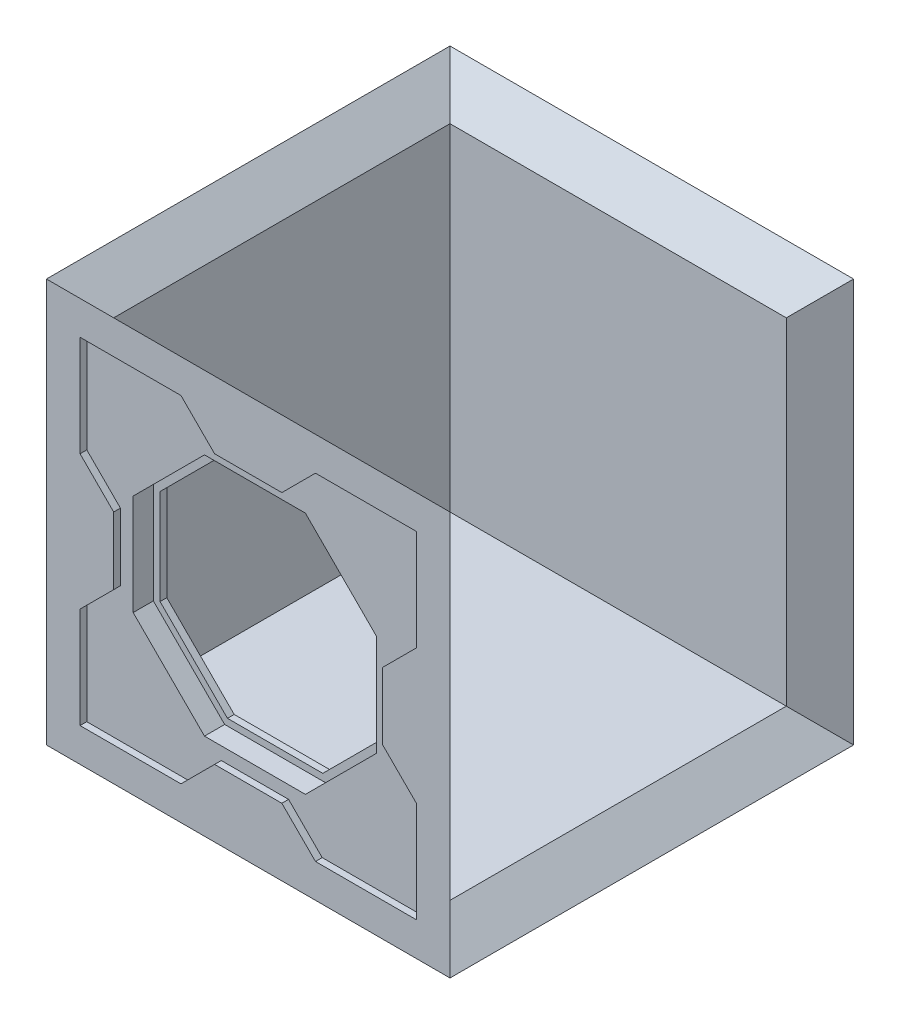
SolidWorks part; units mm, degrees
ref_plane "Front Plane" through (0, 0, 0) normal (0, 0, 1) x (1, 0, 0)
ref_plane "Top Plane" through (0, 0, 0) normal (0, 1, 0) x (1, 0, 0)
ref_plane "Right Plane" through (0, 0, 0) normal (1, 0, 0) x (0, 0, -1)
sketch "Sketch2" plane through (0, 0, 0) normal (0, 1, 0) x (1, 0, 0)
  line L1 (0, 0) -> (120, 0)
  line L2 (0, 0) -> (0, 120)
  line L3 (0, 120) -> (120, 120)
  line L4 (120, 0) -> (120, 120)
  dimension "D1" = 120
  dimension "D2" = 120
extrude "Boss-Extrude1" add sketch "Sketch2" along normal blind 10
sketch "Sketch4" plane through (0, 10, 0) normal (0, 1, 0) x (1, 0, 0)
  line L0 (0, 120) -> (120, 120)
  line L1 (120, 120) -> (120, 110)
  line L2 (120, 0) -> (120, 120) construction
  line L3 (120, 110) -> (10, 110)
  line L4 (10, 110) -> (10, 10)
  line L5 (10, 10) -> (120, 10)
  line L6 (120, 10) -> (120, 0)
  line L7 (120, 0) -> (0, 0)
  line L8 (0, 0) -> (0, 120)
  dimension "D1" = 10
  dimension "D2" = 10
  dimension "D3" = 10
extrude "Boss-Extrude2" add sketch "Sketch4" along normal blind 110
chamfer "Chamfer1" distance 10 angle 45 6 edges at (120, 65, -10) (120, 10, -60) (120, 65, -110) (65, 120, -110) (65, 120, -10) (10, 120, -60)
sketch "Sketch5" plane through (0, 0, -110) normal (0, 0, 1) x (1, 0, 0)
  line L0 (10, 110) -> (10, 10) construction
  line L18 (10, 10) -> (110, 10) construction
  line L19 (47.5, 25) -> (47.5, 22.5)
  line L21 (52.5, 22.5) -> (52.5, 25)
  line L22 (52.5, 25) -> (55, 25)
  line L23 (55, 25) -> (55, 17.5)
  line L24 (55, 17.5) -> (45, 17.5)
  line L25 (45, 17.5) -> (45, 25)
  line L26 (45, 25) -> (47.5, 25)
  line L27 (67.5, 25) -> (65, 25)
  line L28 (65, 25) -> (65, 17.5)
  line L29 (65, 17.5) -> (75, 17.5)
  line L30 (75, 17.5) -> (75, 25)
  line L31 (75, 25) -> (72.5, 25)
  line L32 (72.5, 25) -> (72.5, 22.5)
  line L34 (67.5, 22.5) -> (67.5, 25)
  arc A2 (47.5, 22.5) -> (52.5, 22.5) centre (50, 22.5) ccw
  arc A3 (67.5, 22.5) -> (72.5, 22.5) centre (70, 22.5) ccw
  dimension "D1" = 5
  dimension "D2" = 20
  dimension "D3" = 12.5
  dimension "D4" = 2.5
  dimension "D5" = 40
  dimension "D6" = 5
  dimension "D7" = 5
extrude "Boss-Extrude3" add sketch "Sketch5" along normal blind 100
sketch "Sketch7" plane through (0, 0, 0) normal (0, 0, 1) x (1, 0, 0)
  line L0 (10, 110) -> (40, 110)
  line L1 (40, 110) -> (50, 100)
  line L2 (50, 100) -> (70, 100)
  line L3 (70, 100) -> (80, 110)
  line L4 (80, 110) -> (110, 110)
  line L5 (10, 110) -> (10, 80)
  line L6 (10, 80) -> (20, 70)
  line L7 (20, 70) -> (20, 50)
  line L8 (20, 50) -> (10, 40)
  line L9 (10, 40) -> (10, 10)
  line L10 (10, 10) -> (40, 10)
  line L11 (40, 10) -> (50, 20)
  line L12 (50, 20) -> (70, 20)
  line L13 (70, 20) -> (80, 10)
  line L14 (80, 10) -> (110, 10)
  line L15 (110, 10) -> (110, 40)
  line L16 (110, 40) -> (100, 50)
  line L17 (100, 50) -> (100, 70)
  line L18 (100, 70) -> (110, 80)
  line L19 (110, 80) -> (110, 110)
  line L20 (75, 96.2132) -> (45, 96.2132)
  line L21 (45, 96.2132) -> (23.7868, 75)
  line L22 (23.7868, 75) -> (23.7868, 45)
  line L23 (23.7868, 45) -> (45, 23.7868)
  line L24 (45, 23.7868) -> (75, 23.7868)
  line L25 (75, 23.7868) -> (96.2132, 45)
  line L26 (96.2132, 45) -> (96.2132, 75)
  line L27 (96.2132, 75) -> (75, 96.2132)
  line L28 (10, 110) -> (110, 110) construction
  line L29 (110, 110) -> (110, 10) construction
  line L30 (0, 120) -> (120, 120) construction
  line L31 (60, 120) -> (60, 0) construction
  line L32 (0, 0) -> (120, 0) construction
  line L33 (110, 10) -> (10, 10) construction
  line L34 (0, 120) -> (0, 0) construction
  line L35 (0, 60) -> (120, 60) construction
  line L36 (120, 120) -> (120, 0) construction
  line L37 (120, 60) -> (120, 0) construction
  line L38 (10, 10) -> (10, 110) construction
  circle A0 centre (60, 60) radius 36.2132 construction
  dimension "D1" = 30
  dimension "D2" = 20
  dimension "D3" = 30
  dimension "D4" = 10
  dimension "D5" = 10
  dimension "D6" = 10
  dimension "D7" = 20
  dimension "D8" = 10
  dimension "D9" = 30
  dimension "D10" = 10
  dimension "D11" = 10
  dimension "D12" = 100
extrude "Cut-Extrude1" cut sketch "Sketch7" against normal blind 2
sketch "Sketch8" plane through (0, 0, 0) normal (-1, 0, 0) x (0, 0, 1)
  line L0 (-110, 110) -> (-80, 110)
  line L1 (-80, 110) -> (-70, 100)
  line L2 (-70, 100) -> (-50, 100)
  line L3 (-50, 100) -> (-40, 110)
  line L4 (-40, 110) -> (-10, 110)
  line L5 (-110, 110) -> (-110, 80)
  line L6 (-110, 80) -> (-100, 70)
  line L7 (-100, 70) -> (-100, 50)
  line L8 (-100, 50) -> (-110, 40)
  line L9 (-110, 40) -> (-110, 10)
  line L10 (-110, 10) -> (-80, 10)
  line L11 (-80, 10) -> (-70, 20)
  line L12 (-70, 20) -> (-50, 20)
  line L13 (-50, 20) -> (-40, 10)
  line L14 (-40, 10) -> (-10, 10)
  line L15 (-10, 10) -> (-10, 40)
  line L16 (-10, 40) -> (-20, 50)
  line L17 (-20, 50) -> (-20, 70)
  line L18 (-20, 70) -> (-10, 80)
  line L19 (-10, 80) -> (-10, 110)
  line L20 (-45, 96.2132) -> (-75, 96.2132)
  line L21 (-75, 96.2132) -> (-96.2132, 75)
  line L22 (-96.2132, 75) -> (-96.2132, 45)
  line L23 (-96.2132, 45) -> (-75, 23.7868)
  line L24 (-75, 23.7868) -> (-45, 23.7868)
  line L25 (-45, 23.7868) -> (-23.7868, 45)
  line L26 (-23.7868, 45) -> (-23.7868, 75)
  line L27 (-23.7868, 75) -> (-45, 96.2132)
  line L28 (-120, 60) -> (0, 60) construction
  line L29 (-120, 120) -> (-120, 0) construction
  line L30 (0, 120) -> (0, 0) construction
  line L32 (-120, 120) -> (0, 120) construction
  line L33 (-60, 120) -> (-60, 0) construction
  line L34 (-120, 0) -> (0, 0) construction
  line L36 (-10, 10) -> (-10, 110) construction
  line L37 (-10, 110) -> (-110, 110) construction
  line L38 (-110, 110) -> (-110, 10) construction
  line L39 (-110, 10) -> (-10, 10) construction
  circle A0 centre (-60, 60) radius 36.2132 construction
  dimension "D1" = 30
  dimension "D2" = 20
  dimension "D3" = 30
  dimension "D4" = 10
  dimension "D5" = 10
  dimension "D6" = 10
  dimension "D7" = 20
  dimension "D8" = 10
  dimension "D9" = 10
  dimension "D10" = 30
  dimension "D11" = 10
  dimension "D12" = 100
extrude "Cut-Extrude2" cut sketch "Sketch8" against normal blind 2
sketch "Sketch9" plane through (0, 0, -120) normal (0, 0, -1) x (-1, 0, 0)
  line L0 (-120, 60) -> (0, 60) construction
  line L1 (-120, 120) -> (-120, 0) construction
  line L2 (0, 120) -> (0, 0) construction
  line L3 (-110, 110) -> (-80, 110)
  line L4 (-120, 120) -> (0, 120) construction
  line L5 (-60, 120) -> (-60, 0) construction
  line L6 (-120, 0) -> (0, 0) construction
  line L7 (-80, 110) -> (-70, 100)
  line L8 (-110, 10) -> (-110, 110) construction
  line L9 (-110, 110) -> (-10, 110) construction
  line L10 (-10, 110) -> (-10, 10) construction
  line L11 (-10, 10) -> (-110, 10) construction
  line L12 (-70, 100) -> (-50, 100)
  line L13 (-50, 100) -> (-40, 110)
  line L14 (-40, 110) -> (-10, 110)
  line L15 (-110, 110) -> (-110, 80)
  line L16 (-110, 80) -> (-100, 70)
  line L17 (-100, 70) -> (-100, 50)
  line L18 (-100, 50) -> (-110, 40)
  line L19 (-110, 40) -> (-110, 10)
  line L20 (-110, 10) -> (-80, 10)
  line L21 (-80, 10) -> (-70, 20)
  line L22 (-70, 20) -> (-50, 20)
  line L23 (-50, 20) -> (-40, 10)
  line L24 (-40, 10) -> (-10, 10)
  line L25 (-10, 10) -> (-10, 40)
  line L26 (-10, 40) -> (-20, 50)
  line L27 (-20, 50) -> (-20, 70)
  line L28 (-20, 70) -> (-10, 80)
  line L29 (-10, 80) -> (-10, 110)
  line L30 (-45, 96.2132) -> (-75, 96.2132)
  line L31 (-75, 96.2132) -> (-96.2132, 75)
  line L32 (-96.2132, 75) -> (-96.2132, 45)
  line L33 (-96.2132, 45) -> (-75, 23.7868)
  line L34 (-75, 23.7868) -> (-45, 23.7868)
  line L35 (-45, 23.7868) -> (-23.7868, 45)
  line L36 (-23.7868, 45) -> (-23.7868, 75)
  line L37 (-23.7868, 75) -> (-45, 96.2132)
  line L40 (-60, 160.9007) -> (-60, 40.9007) construction
  circle A0 centre (-60, 60) radius 36.2132 construction
  dimension "D1" = 10
  dimension "D2" = 100
  dimension "D3" = 10
  dimension "D4" = 30
  dimension "D5" = 20
  dimension "D6" = 30
  dimension "D7" = 10
  dimension "D8" = 10
  dimension "D9" = 10
  dimension "D10" = 20
  dimension "D11" = 10
  dimension "D13" = 30
extrude "Cut-Extrude3" cut sketch "Sketch9" against normal blind 2
sketch "Sketch11" plane through (75, 0, 0) normal (1, 0, 0) x (0, 0, -1)
  line L0 (10, 17.5) -> (110, 17.5) construction
  line L1 (15, 17.5) -> (105, 17.5)
  line L2 (15, 17.5) -> (15, 25)
  line L3 (15, 25) -> (105, 25)
  line L4 (105, 17.5) -> (105, 25)
  line L5 (10, 25) -> (110, 25) construction
  line L6 (110, 17.5) -> (110, 25) construction
  point P8 (105, 21.25)
  dimension "D1" = 90
  dimension "D2" = 5
extrude "Cut-Extrude5" cut sketch "Sketch11" against normal up to surface (30 mm away) contours L3 L4 L1 L2
sketch "Sketch12" plane through (75, 0, 0) normal (1, 0, 0) x (0, 0, -1)
  line L0 (105, 17.5) -> (110, 17.5)
  line L1 (110, 10) -> (110, 110) construction
  line L2 (110, 17.5) -> (110, 25) construction
  line L3 (110, 17.5) -> (110, 12.5)
  line L4 (110, 12.5) -> (105, 17.5)
  line L5 (15, 17.5) -> (10, 17.5)
  line L6 (10, 17.5) -> (10, 12.5)
  line L7 (10, 12.5) -> (15, 17.5)
  dimension "D1" = 5
extrude "Boss-Extrude5" add sketch "Sketch12" against normal up to surface (30 mm away)
fillet "Fillet1" radius 0.5 16 edges at (45, 25, -12.5) (47.5, 25, -12.5) (52.5, 25, -12.5) (55, 25, -12.5) (75, 25, -12.5) (72.5, 25, -12.5) (65, 25, -12.5) (67.5, 25, -12.5) (45, 25, -107.5) (47.5, 25, -107.5) (52.5, 25, -107.5) (55, 25, -107.5) (65, 25, -107.5) (67.5, 25, -107.5) (72.5, 25, -107.5) (75, 25, -107.5)
sketch "Sketch10" plane through (0, 0, 0) normal (0, 0, 1) x (1, 0, 0)
  line L0 (45, 96.2132) -> (75, 96.2132)
  line L1 (75, 96.2132) -> (96.2132, 75)
  line L2 (96.2132, 75) -> (96.2132, 45)
  line L3 (96.2132, 45) -> (75, 23.7868)
  line L4 (75, 23.7868) -> (45, 23.7868)
  line L5 (45, 23.7868) -> (23.7868, 45)
  line L6 (23.7868, 45) -> (23.7868, 75)
  line L7 (23.7868, 75) -> (45, 96.2132)
extrude "Cut-Extrude8" cut sketch "Sketch10" against normal up to surface (10 mm away)
sketch "Sketch16" plane through (0, 0, -10) normal (0, 0, -1) x (-1, 0, 0)
  line L0 (-75, 96.2132) -> (-45, 96.2132)
  line L1 (-45, 96.2132) -> (-23.7868, 75)
  line L2 (-23.7868, 75) -> (-23.7868, 45)
  line L3 (-23.7868, 45) -> (-45, 23.7868)
  line L4 (-45, 23.7868) -> (-75, 23.7868)
  line L5 (-75, 23.7868) -> (-96.2132, 45)
  line L6 (-96.2132, 45) -> (-96.2132, 75)
  line L7 (-96.2132, 75) -> (-75, 96.2132)
  line L9 (-45.8284, 94.2132) -> (-74.1716, 94.2132)
  line L10 (-74.1716, 94.2132) -> (-94.2132, 74.1716)
  line L11 (-94.2132, 74.1716) -> (-94.2132, 45.8284)
  line L12 (-94.2132, 45.8284) -> (-74.1716, 25.7868)
  line L13 (-74.1716, 25.7868) -> (-45.8284, 25.7868)
  line L14 (-45.8284, 25.7868) -> (-25.7868, 45.8284)
  line L15 (-25.7868, 45.8284) -> (-25.7868, 74.1716)
  line L16 (-25.7868, 74.1716) -> (-45.8284, 94.2132)
  circle A0 centre (-60, 60) radius 34.2132 construction
  point P27 (-96.2132, 60)
  dimension "D1" = 2
  dimension "D2" = 2
  dimension "D3" = 2
extrude "Boss-Extrude7" add sketch "Sketch16" against normal blind 2
sketch "Sketch17" plane through (0, 17.5, 0) normal (0, 1, 0) x (1, 0, 0)
  line L1 (55, 110) -> (65, 110)
  line L2 (55, 110) -> (55, 10)
  line L3 (55, 10) -> (65, 10)
  line L4 (65, 110) -> (65, 10)
extrude "Cut-Extrude9" cut sketch "Sketch17" against normal up to surface (7.5 mm away)
sketch "Sketch18" plane through (10, 0, 0) normal (1, 0, 0) x (0, 0, -1)
  line L0 (110, 110) -> (110, 10) construction
  line L1 (10, 10) -> (110, 10)
  line L2 (10, 10) -> (10, 31.3383)
  line L3 (10, 31.3383) -> (110, 31.3383)
  line L4 (110, 10) -> (110, 31.3383)
extrude "Cut-Extrude10" cut sketch "Sketch18" along normal blind 175
